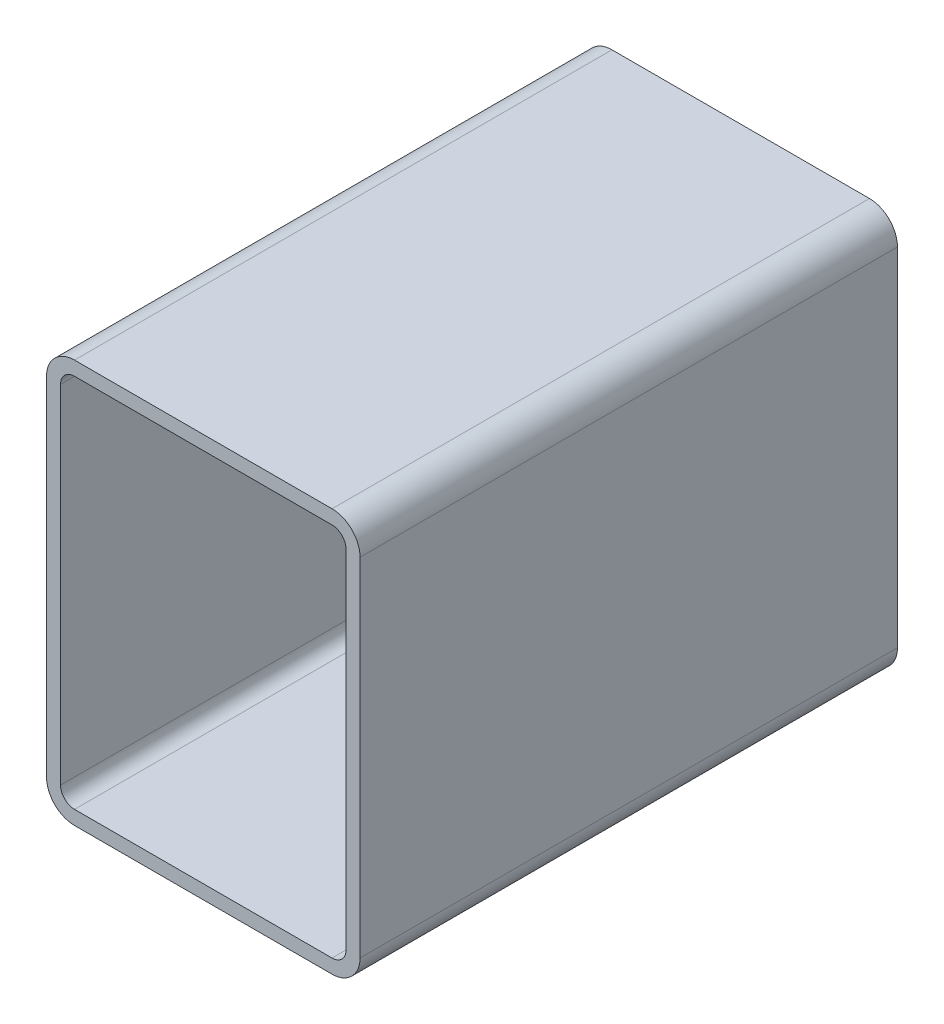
SolidWorks part; units mm, degrees
ref_plane "Front Plane" through (0, 0, 0) normal (0, 0, 1) x (1, 0, 0)
ref_plane "Top Plane" through (0, 0, 0) normal (0, 1, 0) x (1, 0, 0)
ref_plane "Right Plane" through (0, 0, 0) normal (1, 0, 0) x (0, 0, -1)
sketch "Sketch1" plane through (0, 0, 0) normal (0, 0, 1) x (1, 0, 0)
sketch_block_instance "HSS9x7x0.3125-1"
sketch_block "HSS9x7x0.3125"
extrude "Boss-Extrude1" add sketch "Sketch1" along normal blind 304.8
